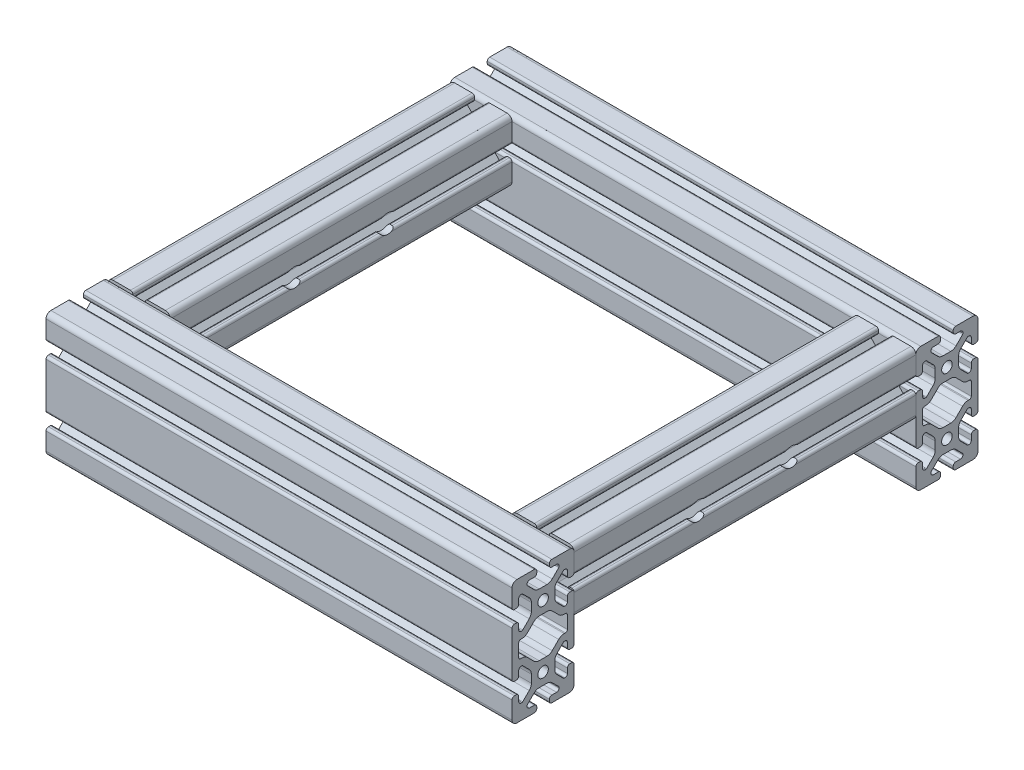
SolidWorks part; units mm, degrees
ref_plane "Front Plane" through (0, 0, 0) normal (0, 0, 1) x (1, 0, 0)
ref_plane "Top Plane" through (0, 0, 0) normal (0, 1, 0) x (1, 0, 0)
ref_plane "Right Plane" through (0, 0, 0) normal (1, 0, 0) x (0, 0, -1)
sketch "Sketch1" plane through (0, 0, 0) normal (0, 1, 0) x (1, 0, 0)
  line L1 (-150, -150) -> (150, -150)
  line L2 (-150, -150) -> (-150, 150)
  line L3 (-150, 150) -> (150, 150)
  line L4 (150, -150) -> (150, 150)
  line L5 (-150, -150) -> (150, 150) construction
  line L6 (-150, 150) -> (150, -150) construction
  point P0 (0, 0)
  dimension "D1" = 300
  dimension "D2" = 300
other "40 40-4040 PROFILE(1)"
ref_plane "Plane3" through (130, -20, 150) normal (0, 0, -1) x (-1, 0, 0)
sketch "Sketch13" plane through (130, -20, 150) normal (0, 0, -1) x (-1, 0, 0)
  line L0 (14.112, -10.285) -> (13.6545, -10.285)
  line L1 (13.1171, -10.0624) -> (8.9198, -5.8651)
  line L2 (7.5286, -2.5064) -> (7.5286, 2.5064)
  line L3 (8.9198, 5.8651) -> (13.1171, 10.0624)
  line L4 (13.6545, 10.285) -> (14.112, 10.285)
  line L5 (15.682, 8.715) -> (15.682, 5.63)
  line L6 (17.252, 4.06) -> (18.43, 4.06)
  line L7 (20, 5.63) -> (20, 16.83)
  line L8 (16.83, 20) -> (5.63, 20)
  line L9 (4.06, 18.43) -> (4.06, 17.252)
  line L10 (5.63, 15.682) -> (8.715, 15.682)
  line L11 (10.285, 14.112) -> (10.285, 13.6545)
  line L12 (10.0624, 13.1171) -> (5.8651, 8.9198)
  line L13 (2.5064, 7.5286) -> (-2.5064, 7.5286)
  line L14 (-5.8651, 8.9198) -> (-10.0624, 13.1171)
  line L15 (-10.285, 13.6545) -> (-10.285, 14.112)
  line L16 (-8.715, 15.682) -> (-5.63, 15.682)
  line L17 (-4.06, 17.252) -> (-4.06, 18.43)
  line L18 (-5.63, 20) -> (-16.83, 20)
  line L19 (-20, 16.83) -> (-20, 5.63)
  line L20 (-18.43, 4.06) -> (-17.252, 4.06)
  line L21 (-15.682, 5.63) -> (-15.682, 8.715)
  line L22 (-14.112, 10.285) -> (-13.6545, 10.285)
  line L23 (-13.1171, 10.0624) -> (-8.9198, 5.8651)
  line L24 (-7.5286, 2.5064) -> (-7.5286, -2.5064)
  line L25 (-8.9198, -5.8651) -> (-13.1171, -10.0624)
  line L26 (-13.6545, -10.285) -> (-14.112, -10.285)
  line L27 (-15.682, -8.715) -> (-15.682, -5.63)
  line L28 (-17.252, -4.06) -> (-18.43, -4.06)
  line L29 (-20, -5.63) -> (-20, -16.83)
  line L30 (-16.83, -20) -> (-5.63, -20)
  line L31 (-4.06, -18.43) -> (-4.06, -17.252)
  line L32 (-5.63, -15.682) -> (-8.715, -15.682)
  line L33 (-10.285, -14.112) -> (-10.285, -13.6545)
  line L34 (-10.0624, -13.1171) -> (-5.8651, -8.9198)
  line L35 (-2.5064, -7.5286) -> (2.5064, -7.5286)
  line L36 (5.8651, -8.9198) -> (10.0624, -13.1171)
  line L37 (10.285, -13.6545) -> (10.285, -14.112)
  line L38 (8.715, -15.682) -> (5.63, -15.682)
  line L39 (4.06, -17.252) -> (4.06, -18.43)
  line L40 (5.63, -20) -> (16.83, -20)
  line L41 (20, -16.83) -> (20, -5.63)
  line L42 (18.43, -4.06) -> (17.252, -4.06)
  line L43 (15.682, -5.63) -> (15.682, -8.715)
  circle A0 centre (0, 0) radius 3.4
  arc A1 (14.112, -10.285) -> (15.682, -8.715) centre (14.112, -8.715) ccw
  arc A2 (13.1171, -10.0624) -> (13.6545, -10.285) centre (13.6545, -9.525) ccw
  arc A3 (7.5286, -2.5064) -> (8.9198, -5.8651) centre (12.2786, -2.5064) ccw
  arc A4 (8.9198, 5.8651) -> (7.5286, 2.5064) centre (12.2786, 2.5064) ccw
  arc A5 (13.6545, 10.285) -> (13.1171, 10.0624) centre (13.6545, 9.525) ccw
  arc A6 (15.682, 8.715) -> (14.112, 10.285) centre (14.112, 8.715) ccw
  arc A7 (15.682, 5.63) -> (17.252, 4.06) centre (17.252, 5.63) ccw
  arc A8 (18.43, 4.06) -> (20, 5.63) centre (18.43, 5.63) ccw
  arc A9 (20, 16.83) -> (16.83, 20) centre (16.83, 16.83) ccw
  arc A10 (5.63, 20) -> (4.06, 18.43) centre (5.63, 18.43) ccw
  arc A11 (4.06, 17.252) -> (5.63, 15.682) centre (5.63, 17.252) ccw
  arc A12 (10.285, 14.112) -> (8.715, 15.682) centre (8.715, 14.112) ccw
  arc A13 (10.0624, 13.1171) -> (10.285, 13.6545) centre (9.525, 13.6545) ccw
  arc A14 (2.5064, 7.5286) -> (5.8651, 8.9198) centre (2.5064, 12.2786) ccw
  arc A15 (-5.8651, 8.9198) -> (-2.5064, 7.5286) centre (-2.5064, 12.2786) ccw
  arc A16 (-10.285, 13.6545) -> (-10.0624, 13.1171) centre (-9.525, 13.6545) ccw
  arc A17 (-8.715, 15.682) -> (-10.285, 14.112) centre (-8.715, 14.112) ccw
  arc A18 (-5.63, 15.682) -> (-4.06, 17.252) centre (-5.63, 17.252) ccw
  arc A19 (-4.06, 18.43) -> (-5.63, 20) centre (-5.63, 18.43) ccw
  arc A20 (-16.83, 20) -> (-20, 16.83) centre (-16.83, 16.83) ccw
  arc A21 (-20, 5.63) -> (-18.43, 4.06) centre (-18.43, 5.63) ccw
  arc A22 (-17.252, 4.06) -> (-15.682, 5.63) centre (-17.252, 5.63) ccw
  arc A23 (-14.112, 10.285) -> (-15.682, 8.715) centre (-14.112, 8.715) ccw
  arc A24 (-13.1171, 10.0624) -> (-13.6545, 10.285) centre (-13.6545, 9.525) ccw
  arc A25 (-7.5286, 2.5064) -> (-8.9198, 5.8651) centre (-12.2786, 2.5064) ccw
  arc A26 (-8.9198, -5.8651) -> (-7.5286, -2.5064) centre (-12.2786, -2.5064) ccw
  arc A27 (-13.6545, -10.285) -> (-13.1171, -10.0624) centre (-13.6545, -9.525) ccw
  arc A28 (-15.682, -8.715) -> (-14.112, -10.285) centre (-14.112, -8.715) ccw
  arc A29 (-15.682, -5.63) -> (-17.252, -4.06) centre (-17.252, -5.63) ccw
  arc A30 (-18.43, -4.06) -> (-20, -5.63) centre (-18.43, -5.63) ccw
  arc A31 (-20, -16.83) -> (-16.83, -20) centre (-16.83, -16.83) ccw
  arc A32 (-5.63, -20) -> (-4.06, -18.43) centre (-5.63, -18.43) ccw
  arc A33 (-4.06, -17.252) -> (-5.63, -15.682) centre (-5.63, -17.252) ccw
  arc A34 (-10.285, -14.112) -> (-8.715, -15.682) centre (-8.715, -14.112) ccw
  arc A35 (-10.0624, -13.1171) -> (-10.285, -13.6545) centre (-9.525, -13.6545) ccw
  arc A36 (-2.5064, -7.5286) -> (-5.8651, -8.9198) centre (-2.5064, -12.2786) ccw
  arc A37 (5.8651, -8.9198) -> (2.5064, -7.5286) centre (2.5064, -12.2786) ccw
  arc A38 (10.285, -13.6545) -> (10.0624, -13.1171) centre (9.525, -13.6545) ccw
  arc A39 (8.715, -15.682) -> (10.285, -14.112) centre (8.715, -14.112) ccw
  arc A40 (5.63, -15.682) -> (4.06, -17.252) centre (5.63, -17.252) ccw
  arc A41 (4.06, -18.43) -> (5.63, -20) centre (5.63, -18.43) ccw
  arc A42 (16.83, -20) -> (20, -16.83) centre (16.83, -16.83) ccw
  arc A43 (20, -5.63) -> (18.43, -4.06) centre (18.43, -5.63) ccw
  arc A44 (17.252, -4.06) -> (15.682, -5.63) centre (17.252, -5.63) ccw
  point P0 (-20, 20)
  point P1 (0, 20)
  point P2 (20, 20)
  point P137 (20, 0)
  point P138 (20, -20)
  point P139 (0, -20)
  point P140 (-20, -20)
  point P141 (-20, 0)
  point P142 (0, 0)
other "40 40-4080 PROFILE(1)"
ref_plane "Plane7" through (-150, -60, 130) normal (1, 0, 0) x (0, 0, -1)
sketch "Sketch17" plane through (-150, -60, 130) normal (1, 0, 0) x (0, 0, -1)
  line L0 (15.68, 24.125) -> (15.68, 15.875)
  line L1 (14.41, 14.605) -> (13.6545, 14.605)
  line L2 (10.0624, 13.1171) -> (5.8651, 8.9198)
  line L3 (2.5064, 7.5286) -> (-2.5064, 7.5286)
  line L4 (-5.8651, 8.9198) -> (-10.0624, 13.1171)
  line L5 (-13.6545, 14.605) -> (-14.41, 14.605)
  line L6 (-15.68, 15.875) -> (-15.68, 24.125)
  line L7 (-14.41, 25.395) -> (-13.6545, 25.395)
  line L8 (-10.0624, 26.8829) -> (-5.8651, 31.0802)
  line L9 (-2.5064, 32.4714) -> (2.5064, 32.4714)
  line L10 (5.8651, 31.0802) -> (10.0624, 26.8829)
  line L11 (13.6545, 25.395) -> (14.41, 25.395)
  line L12 (20, 5.63) -> (20, 34.37)
  line L13 (18.43, 35.94) -> (17.252, 35.94)
  line L14 (15.682, 34.37) -> (15.682, 31.285)
  line L15 (14.112, 29.715) -> (13.6545, 29.715)
  line L16 (13.1171, 29.9376) -> (8.9198, 34.1349)
  line L17 (7.5286, 37.4936) -> (7.5286, 42.5064)
  line L18 (8.9198, 45.8651) -> (13.1171, 50.0624)
  line L19 (13.6545, 50.285) -> (14.112, 50.285)
  line L20 (15.682, 48.715) -> (15.682, 45.63)
  line L21 (17.252, 44.06) -> (18.43, 44.06)
  line L22 (20, 45.63) -> (20, 56.83)
  line L23 (16.83, 60) -> (5.63, 60)
  line L24 (4.06, 58.43) -> (4.06, 57.252)
  line L25 (5.63, 55.682) -> (8.715, 55.682)
  line L26 (10.285, 54.112) -> (10.285, 53.6545)
  line L27 (10.0624, 53.1171) -> (5.8651, 48.9198)
  line L28 (2.5064, 47.5286) -> (-2.5064, 47.5286)
  line L29 (-5.8651, 48.9198) -> (-10.0624, 53.1171)
  line L30 (-10.285, 53.6545) -> (-10.285, 54.112)
  line L31 (-8.715, 55.682) -> (-5.63, 55.682)
  line L32 (-4.06, 57.252) -> (-4.06, 58.43)
  line L33 (-5.63, 60) -> (-16.83, 60)
  line L34 (-20, 56.83) -> (-20, 45.63)
  line L35 (-18.43, 44.06) -> (-17.252, 44.06)
  line L36 (-15.682, 45.63) -> (-15.682, 48.715)
  line L37 (-14.112, 50.285) -> (-13.6545, 50.285)
  line L38 (-13.1171, 50.0624) -> (-8.9198, 45.8651)
  line L39 (-7.5286, 42.5064) -> (-7.5286, 37.4936)
  line L40 (-8.9198, 34.1349) -> (-13.1171, 29.9376)
  line L41 (-13.6545, 29.715) -> (-14.112, 29.715)
  line L42 (-15.682, 31.285) -> (-15.682, 34.37)
  line L43 (-17.252, 35.94) -> (-18.43, 35.94)
  line L44 (-20, 34.37) -> (-20, 5.63)
  line L45 (-18.43, 4.06) -> (-17.252, 4.06)
  line L46 (-15.682, 5.63) -> (-15.682, 8.715)
  line L47 (-14.112, 10.285) -> (-13.6545, 10.285)
  line L48 (-13.1171, 10.0624) -> (-8.9198, 5.8651)
  line L49 (-7.5286, 2.5064) -> (-7.5286, -2.5064)
  line L50 (-8.9198, -5.8651) -> (-13.1171, -10.0624)
  line L51 (-13.6545, -10.285) -> (-14.112, -10.285)
  line L52 (-15.682, -8.715) -> (-15.682, -5.63)
  line L53 (-17.252, -4.06) -> (-18.43, -4.06)
  line L54 (-20, -5.63) -> (-20, -16.83)
  line L55 (-16.83, -20) -> (-5.63, -20)
  line L56 (-4.06, -18.43) -> (-4.06, -17.252)
  line L57 (-5.63, -15.682) -> (-8.715, -15.682)
  line L58 (-10.285, -14.112) -> (-10.285, -13.6545)
  line L59 (-10.0624, -13.1171) -> (-5.8651, -8.9198)
  line L60 (-2.5064, -7.5286) -> (2.5064, -7.5286)
  line L61 (5.8651, -8.9198) -> (10.0624, -13.1171)
  line L62 (10.285, -13.6545) -> (10.285, -14.112)
  line L63 (8.715, -15.682) -> (5.63, -15.682)
  line L64 (4.06, -17.252) -> (4.06, -18.43)
  line L65 (5.63, -20) -> (16.83, -20)
  line L66 (20, -16.83) -> (20, -5.63)
  line L67 (18.43, -4.06) -> (17.252, -4.06)
  line L68 (15.682, -5.63) -> (15.682, -8.715)
  line L69 (14.112, -10.285) -> (13.6545, -10.285)
  line L70 (13.1171, -10.0624) -> (8.9198, -5.8651)
  line L71 (7.5286, -2.5064) -> (7.5286, 2.5064)
  line L72 (8.9198, 5.8651) -> (13.1171, 10.0624)
  line L73 (13.6545, 10.285) -> (14.112, 10.285)
  line L74 (15.682, 8.715) -> (15.682, 5.63)
  line L75 (17.252, 4.06) -> (18.43, 4.06)
  circle A0 centre (0, 0) radius 3.4
  arc A1 (15.68, 24.125) -> (14.41, 25.395) centre (14.41, 24.125) ccw
  arc A2 (14.41, 14.605) -> (15.68, 15.875) centre (14.41, 15.875) ccw
  arc A3 (13.6545, 14.605) -> (10.0624, 13.1171) centre (13.6545, 9.525) ccw
  arc A4 (2.5064, 7.5286) -> (5.8651, 8.9198) centre (2.5064, 12.2786) ccw
  arc A5 (-5.8651, 8.9198) -> (-2.5064, 7.5286) centre (-2.5064, 12.2786) ccw
  arc A6 (-10.0624, 13.1171) -> (-13.6545, 14.605) centre (-13.6545, 9.525) ccw
  arc A7 (-15.68, 15.875) -> (-14.41, 14.605) centre (-14.41, 15.875) ccw
  arc A8 (-14.41, 25.395) -> (-15.68, 24.125) centre (-14.41, 24.125) ccw
  arc A9 (-13.6545, 25.395) -> (-10.0624, 26.8829) centre (-13.6545, 30.475) ccw
  arc A10 (-2.5064, 32.4714) -> (-5.8651, 31.0802) centre (-2.5064, 27.7214) ccw
  arc A11 (5.8651, 31.0802) -> (2.5064, 32.4714) centre (2.5064, 27.7214) ccw
  arc A12 (10.0624, 26.8829) -> (13.6545, 25.395) centre (13.6545, 30.475) ccw
  circle A13 centre (0, 40) radius 3.4
  arc A14 (18.43, 4.06) -> (20, 5.63) centre (18.43, 5.63) ccw
  arc A15 (20, 34.37) -> (18.43, 35.94) centre (18.43, 34.37) ccw
  arc A16 (17.252, 35.94) -> (15.682, 34.37) centre (17.252, 34.37) ccw
  arc A17 (14.112, 29.715) -> (15.682, 31.285) centre (14.112, 31.285) ccw
  arc A18 (13.1171, 29.9376) -> (13.6545, 29.715) centre (13.6545, 30.475) ccw
  arc A19 (7.5286, 37.4936) -> (8.9198, 34.1349) centre (12.2786, 37.4936) ccw
  arc A20 (8.9198, 45.8651) -> (7.5286, 42.5064) centre (12.2786, 42.5064) ccw
  arc A21 (13.6545, 50.285) -> (13.1171, 50.0624) centre (13.6545, 49.525) ccw
  arc A22 (15.682, 48.715) -> (14.112, 50.285) centre (14.112, 48.715) ccw
  arc A23 (15.682, 45.63) -> (17.252, 44.06) centre (17.252, 45.63) ccw
  arc A24 (18.43, 44.06) -> (20, 45.63) centre (18.43, 45.63) ccw
  arc A25 (20, 56.83) -> (16.83, 60) centre (16.83, 56.83) ccw
  arc A26 (5.63, 60) -> (4.06, 58.43) centre (5.63, 58.43) ccw
  arc A27 (4.06, 57.252) -> (5.63, 55.682) centre (5.63, 57.252) ccw
  arc A28 (10.285, 54.112) -> (8.715, 55.682) centre (8.715, 54.112) ccw
  arc A29 (10.0624, 53.1171) -> (10.285, 53.6545) centre (9.525, 53.6545) ccw
  arc A30 (2.5064, 47.5286) -> (5.8651, 48.9198) centre (2.5064, 52.2786) ccw
  arc A31 (-5.8651, 48.9198) -> (-2.5064, 47.5286) centre (-2.5064, 52.2786) ccw
  arc A32 (-10.285, 53.6545) -> (-10.0624, 53.1171) centre (-9.525, 53.6545) ccw
  arc A33 (-8.715, 55.682) -> (-10.285, 54.112) centre (-8.715, 54.112) ccw
  arc A34 (-5.63, 55.682) -> (-4.06, 57.252) centre (-5.63, 57.252) ccw
  arc A35 (-4.06, 58.43) -> (-5.63, 60) centre (-5.63, 58.43) ccw
  arc A36 (-16.83, 60) -> (-20, 56.83) centre (-16.83, 56.83) ccw
  arc A37 (-20, 45.63) -> (-18.43, 44.06) centre (-18.43, 45.63) ccw
  arc A38 (-17.252, 44.06) -> (-15.682, 45.63) centre (-17.252, 45.63) ccw
  arc A39 (-14.112, 50.285) -> (-15.682, 48.715) centre (-14.112, 48.715) ccw
  arc A40 (-13.1171, 50.0624) -> (-13.6545, 50.285) centre (-13.6545, 49.525) ccw
  arc A41 (-7.5286, 42.5064) -> (-8.9198, 45.8651) centre (-12.2786, 42.5064) ccw
  arc A42 (-8.9198, 34.1349) -> (-7.5286, 37.4936) centre (-12.2786, 37.4936) ccw
  arc A43 (-13.6545, 29.715) -> (-13.1171, 29.9376) centre (-13.6545, 30.475) ccw
  arc A44 (-15.682, 31.285) -> (-14.112, 29.715) centre (-14.112, 31.285) ccw
  arc A45 (-15.682, 34.37) -> (-17.252, 35.94) centre (-17.252, 34.37) ccw
  arc A46 (-18.43, 35.94) -> (-20, 34.37) centre (-18.43, 34.37) ccw
  arc A47 (-20, 5.63) -> (-18.43, 4.06) centre (-18.43, 5.63) ccw
  arc A48 (-17.252, 4.06) -> (-15.682, 5.63) centre (-17.252, 5.63) ccw
  arc A49 (-14.112, 10.285) -> (-15.682, 8.715) centre (-14.112, 8.715) ccw
  arc A50 (-13.1171, 10.0624) -> (-13.6545, 10.285) centre (-13.6545, 9.525) ccw
  arc A51 (-7.5286, 2.5064) -> (-8.9198, 5.8651) centre (-12.2786, 2.5064) ccw
  arc A52 (-8.9198, -5.8651) -> (-7.5286, -2.5064) centre (-12.2786, -2.5064) ccw
  arc A53 (-13.6545, -10.285) -> (-13.1171, -10.0624) centre (-13.6545, -9.525) ccw
  arc A54 (-15.682, -8.715) -> (-14.112, -10.285) centre (-14.112, -8.715) ccw
  arc A55 (-15.682, -5.63) -> (-17.252, -4.06) centre (-17.252, -5.63) ccw
  arc A56 (-18.43, -4.06) -> (-20, -5.63) centre (-18.43, -5.63) ccw
  arc A57 (-20, -16.83) -> (-16.83, -20) centre (-16.83, -16.83) ccw
  arc A58 (-5.63, -20) -> (-4.06, -18.43) centre (-5.63, -18.43) ccw
  arc A59 (-4.06, -17.252) -> (-5.63, -15.682) centre (-5.63, -17.252) ccw
  arc A60 (-10.285, -14.112) -> (-8.715, -15.682) centre (-8.715, -14.112) ccw
  arc A61 (-10.0624, -13.1171) -> (-10.285, -13.6545) centre (-9.525, -13.6545) ccw
  arc A62 (-2.5064, -7.5286) -> (-5.8651, -8.9198) centre (-2.5064, -12.2786) ccw
  arc A63 (5.8651, -8.9198) -> (2.5064, -7.5286) centre (2.5064, -12.2786) ccw
  arc A64 (10.285, -13.6545) -> (10.0624, -13.1171) centre (9.525, -13.6545) ccw
  arc A65 (8.715, -15.682) -> (10.285, -14.112) centre (8.715, -14.112) ccw
  arc A66 (5.63, -15.682) -> (4.06, -17.252) centre (5.63, -17.252) ccw
  arc A67 (4.06, -18.43) -> (5.63, -20) centre (5.63, -18.43) ccw
  arc A68 (16.83, -20) -> (20, -16.83) centre (16.83, -16.83) ccw
  arc A69 (20, -5.63) -> (18.43, -4.06) centre (18.43, -5.63) ccw
  arc A70 (17.252, -4.06) -> (15.682, -5.63) centre (17.252, -5.63) ccw
  arc A71 (14.112, -10.285) -> (15.682, -8.715) centre (14.112, -8.715) ccw
  arc A72 (13.1171, -10.0624) -> (13.6545, -10.285) centre (13.6545, -9.525) ccw
  arc A73 (7.5286, -2.5064) -> (8.9198, -5.8651) centre (12.2786, -2.5064) ccw
  arc A74 (8.9198, 5.8651) -> (7.5286, 2.5064) centre (12.2786, 2.5064) ccw
  arc A75 (13.6545, 10.285) -> (13.1171, 10.0624) centre (13.6545, 9.525) ccw
  arc A76 (15.682, 8.715) -> (14.112, 10.285) centre (14.112, 8.715) ccw
  arc A77 (15.682, 5.63) -> (17.252, 4.06) centre (17.252, 5.63) ccw
  point P0 (-20, 60)
  point P1 (0, 60)
  point P2 (20, 60)
  point P231 (20, 40)
  point P232 (-20, 40)
  point P233 (-20, 20)
  point P234 (0, 20)
  point P235 (20, 20)
  point P236 (20, 0)
  point P237 (20, -20)
  point P238 (0, -20)
  point P239 (-20, -20)
  point P240 (-20, 0)
  point P241 (0, 40)
  point P242 (0, 0)
other "Trim/Extend1"
sketch "Sketch20" plane through (150, 0, 0) normal (1, 0, 0) x (0, 0, -1)
  line L0 (0, 0) -> (0, -40) construction
  line L1 (110, -40) -> (-110, -40) construction
  circle A0 centre (30, -20) radius 6
  circle A1 centre (-30, -20) radius 6
  point P7 (0, 0)
  point P8 (0, 0)
  point P9 (0, -20)
  dimension "D2" = 12
  dimension "D1" = 30
extrude "Cut-Extrude1" cut sketch "Sketch20" against normal through all
